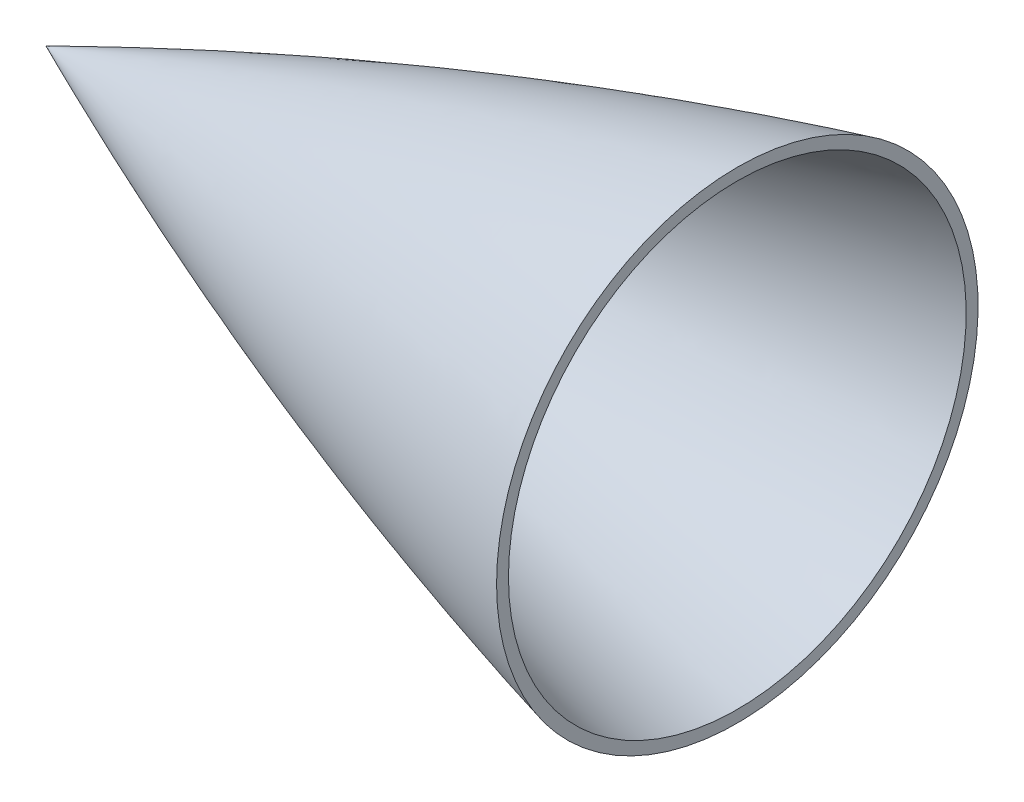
SolidWorks part; units mm, degrees
ref_plane "Front Plane" through (0, 0, 0) normal (0, 0, 1) x (1, 0, 0)
ref_plane "Top Plane" through (0, 0, 0) normal (0, 1, 0) x (1, 0, 0)
ref_plane "Right Plane" through (0, 0, 0) normal (1, 0, 0) x (0, 0, -1)
sketch "Sketch1" plane through (0, 0, 0) normal (0, 0, 1) x (1, 0, 0)
  line L0 (0, 0) -> (885.7967, 0) construction
  line L1 (762, 265.3766) -> (762, 252.2638)
  line L2 (0, 0) -> (31.6335, 0)
  spline S0 degree 3 poles (4629.5249, -589.8258) (2084.6797, 1343.1342) (-693.722, 207.8898) (-2332.3611, -1846.3182) knots -1.425816 -1.425816 -1.425816 -1.425816 2.529051 2.529051 2.529051 2.529051 only from (1850.39, 405.13) to (0, 0) construction
  spline S2 degree 3 poles (762, 265.3766) (502.1547, 198.6938) (247.5944, 109.3581) (0, 0) knots 0.576959 0.576959 0.576959 0.576959 1 1 1 1
  spline S8 degree 3 poles (-844.6655, 481.7525) (-299.3346, 116.1047) (296.8825, -153.0945) (1541.5435, -426.4946) (2189.6504, -432.2808) (2843.1653, -272.5512) knots -0.526637 -0.526637 -0.526637 -0.526637 0.5 0.5 1.520481 1.520481 1.520481 1.520481 only from (31.6335, 0) to (1850.39, -392.43)
  spline S9 degree 3 poles (5374.4849, -1270.6611) (3924.3857, 226.072) (2349.4708, 603.9625) (-639.4882, -52.5871) (-2025.1409, -1221.0023) (-2877.9927, -2658.1003) knots -1.849294 -1.849294 -1.849294 -1.849294 0.5 0.5 3.066703 3.066703 3.066703 3.066703 only from (1850.39, 392.43) to (31.6335, 0)
  spline S11 degree 3 poles (762, 252.2638) (513.2177, 188.2334) (269.2672, 103.3752) (31.6335, 0) knots 0.587559 0.587559 0.587559 0.587559 1 1 1 1
  dimension "D1" = 762
  dimension "D2" = 12.7
revolve "Revolve5" add sketch "Sketch1" angle 360 about L0
